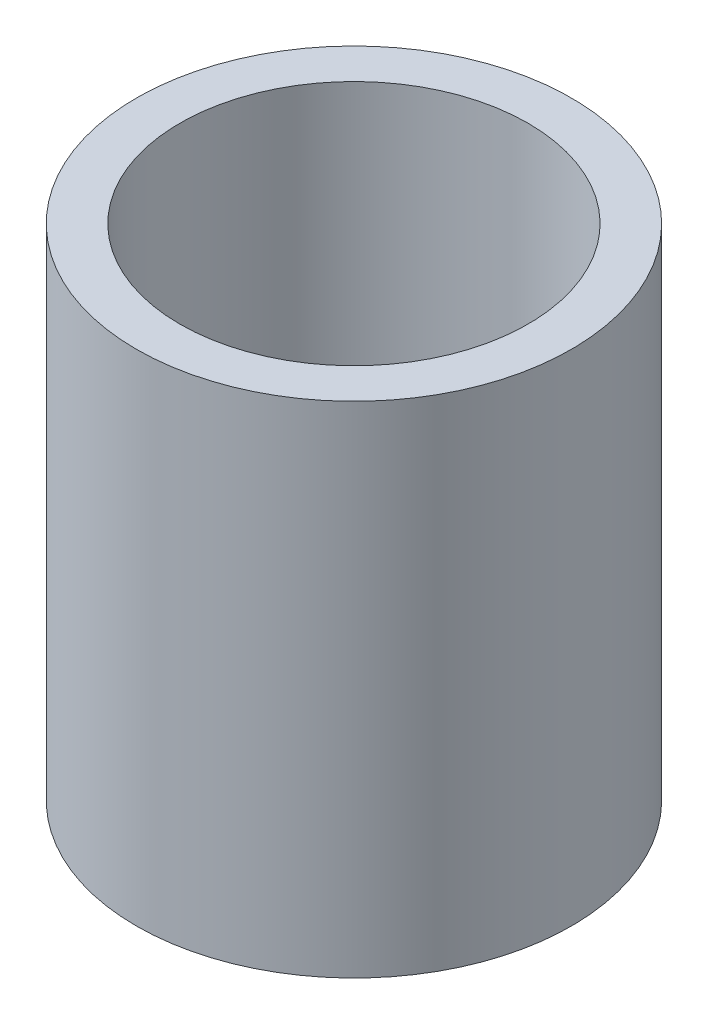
SolidWorks part; units mm, degrees
ref_plane "Front" through (0, 0, 0) normal (0, 0, 1) x (1, 0, 0)
ref_plane "Top" through (0, 0, 0) normal (0, 1, 0) x (1, 0, 0)
ref_plane "Right" through (0, 0, 0) normal (1, 0, 0) x (0, 0, -1)
sketch "Sketch1" plane through (0, 0, 0) normal (0, 1, 0) x (1, 0, 0)
  circle A0 centre (0, 0) radius 46
  circle A1 centre (0, 0) radius 57.5
  dimension "D1" = 92
  dimension "D2" = 115
extrude "Extrude1" add sketch "Sketch1" along normal blind 132
